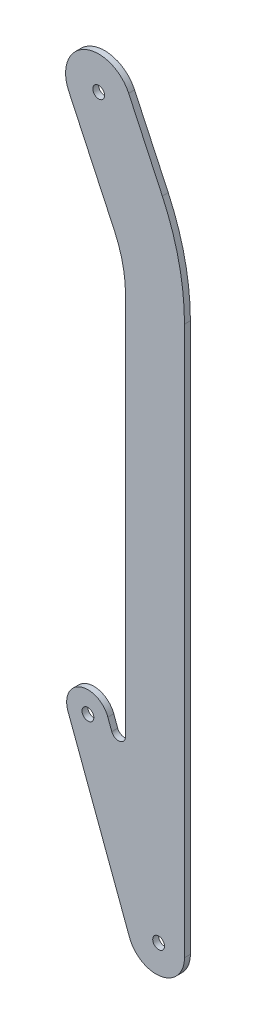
SolidWorks part; units mm, degrees
ref_plane "Plan de face" through (0, 0, 0) normal (0, 0, 1) x (1, 0, 0)
ref_plane "Plan de dessus" through (0, 0, 0) normal (0, 1, 0) x (1, 0, 0)
ref_plane "Plan de droite" through (0, 0, 0) normal (1, 0, 0) x (0, 0, -1)
sketch "Esquisse1" plane through (0, 0, 0) normal (0, 0, 1) x (1, 0, 0)
  line L0 (0, 0) -> (-29.9062, 68.7795) construction
  line L1 (0, 0) -> (0, 244.548) construction
  line L2 (0, 244.548) -> (-25.3571, 298.9264) construction
  line L3 (-38.3394, 65.6361) -> (-12.3115, -4.1913)
  line L4 (10.9328, 0) -> (10.9328, 232.0599)
  line L5 (-14, 230.3595) -> (-14, 68.5122)
  line L6 (-21.473, 71.923) -> (-19.8111, 67.4644)
  line L7 (-35.2364, 57.3114) -> (-8.8548, 68.7825) construction
  line L8 (-38.0454, 293.0098) -> (-18.6846, 251.4904)
  line L9 (-12.6688, 304.8431) -> (1.5636, 274.3217)
  arc A1 (-21.473, 71.923) -> (-38.3394, 65.6361) centre (-29.9062, 68.7795) ccw
  circle A2 centre (-29.9062, 68.7795) radius 2.5
  arc A3 (-19.8111, 67.4644) -> (-14, 68.5122) centre (-17, 68.5122) ccw
  arc A5 (-12.6688, 304.8431) -> (-38.0454, 293.0098) centre (-25.3571, 298.9264) ccw
  arc A6 (10.9328, 232.0599) -> (1.5636, 274.3217) centre (-89.0672, 232.0599) ccw
  arc A7 (-14, 230.3595) -> (-18.6846, 251.4904) centre (-64, 230.3595) ccw
  circle A8 centre (-25.3571, 298.9264) radius 2.5
  circle A9 centre (0, 0) radius 2.5
  arc A10 (-12.3115, -4.1913) -> (10.9328, 0) centre (-1.0672, 0) ccw
  point P8 (-17, 62.059)
  point P19 (-24.1052, -19.0526)
  point P26 (-17, 66.8007)
  point P28 (-6.6139, 0)
  point P29 (-3.4727, 0)
  point P31 (-19.8018, 65.299)
  point P32 (-14, 66.3713)
  point P33 (-19.8018, 65.299)
  point P34 (-22.264, 72.1328)
  dimension "D3" = 24
  dimension "D4" = 18
  dimension "D5" = 5
  dimension "D7" = 3
  dimension "D10" = 28
  dimension "D11" = 200
  dimension "D12" = 100
  dimension "D13" = 5
  dimension "D14" = 5
  dimension "D15" = 23.5
  dimension "D1" = 25
  dimension "D2" = 75
  dimension "D6" = 14
  dimension "D8" = 60
  dimension "D9" = 300
  dimension "D16" = 13
base flange "Tôle de base pliée1" sketch "Esquisse1" thickness 2.5 reverse thickness direction no parameters "D1"=4
sketch "Lignes de pliage1" [suppressed] plane through (0, 0, 0) normal (0, 1, 0) x (1, 0, 0)
sketch "Cube de visualisation1" [suppressed] plane through (0, 0, 0) normal (0, 1, 0) x (1, 0, 0)
sheet metal parameters "Tôlerie1" thickness 2.5 parameters "D1"=4
flat pattern "Etat déplié1"
sketch "Lignes de pliage2" plane through (0, 0, 0) normal (0, 1, 0) x (1, 0, 0)
sketch3d "Cube de visualisation2" [suppressed]
  line L0 (36.1315, 14.0708, 0) -> (36.7682, -310.902, 0) construction
  line L1 (-14.0274, 13.9725, 0) -> (-13.3907, -311.0003, 0) construction
  line L2 (36.1315, 14.0708, 0) -> (-14.0274, 13.9725, 0) construction
  line L3 (36.7682, -310.902, 0) -> (-13.3907, -311.0003, 0) construction
